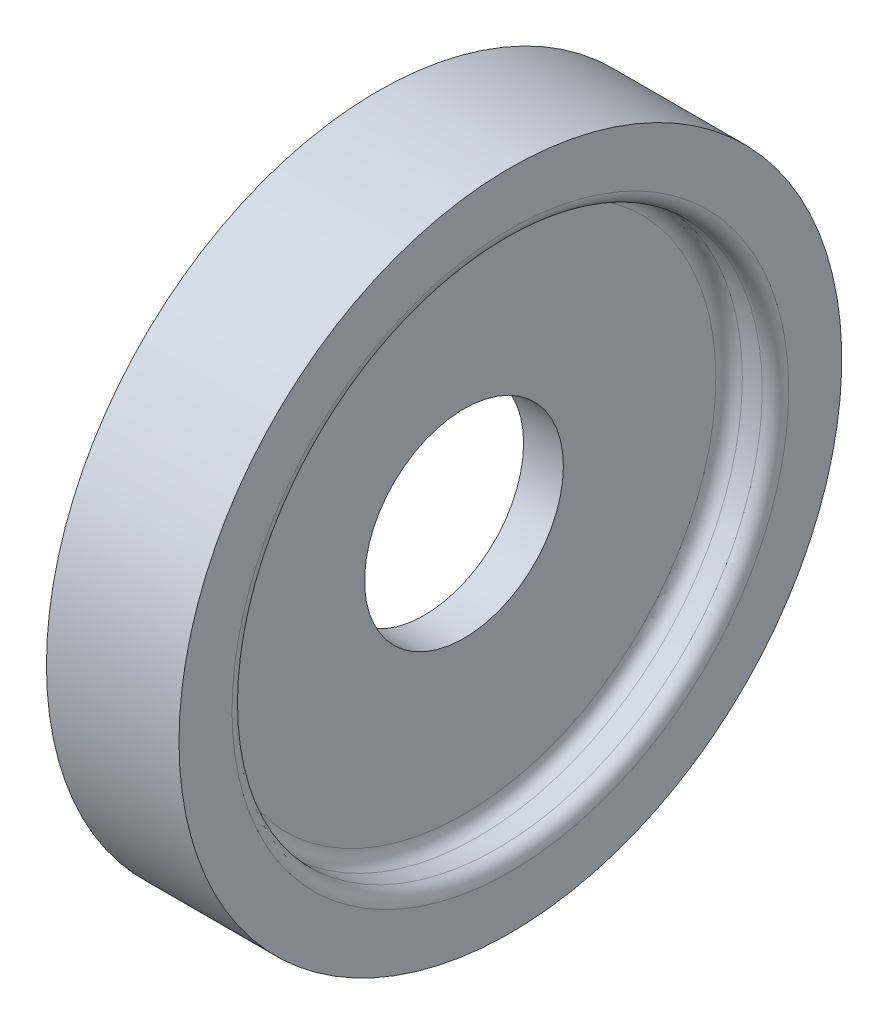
SolidWorks part; units mm, degrees
ref_plane "Front Plane" through (0, 0, 0) normal (0, 0, 1) x (1, 0, 0)
ref_plane "Top Plane" through (0, 0, 0) normal (0, 1, 0) x (1, 0, 0)
ref_plane "Right Plane" through (0, 0, 0) normal (1, 0, 0) x (0, 0, -1)
sketch "Sketch1" plane through (0, 0, 0) normal (0, 0, 1) x (1, 0, 0)
  line L0 (-24.414, 0) -> (24.9194, 0) construction
  line L1 (-1.5, 0) -> (1.5, 0)
  line L2 (1.5, 0) -> (1.5, 19)
  line L3 (2.5, 20) -> (4, 20)
  line L4 (5, 21) -> (5, 25)
  line L5 (5, 25) -> (-5, 25)
  line L6 (-5, 25) -> (-5, 21)
  line L7 (-4, 20) -> (-2.5, 20)
  line L8 (-1.5, 19) -> (-1.5, 0)
  arc A0 (4, 20) -> (5, 21) centre (4, 21) ccw
  arc A1 (-5, 21) -> (-4, 20) centre (-4, 21) ccw
  arc A2 (1.5, 19) -> (2.5, 20) centre (2.5, 19) cw
  arc A3 (-2.5, 20) -> (-1.5, 19) centre (-2.5, 19) cw
  point P8 (0, 0)
  point P12 (0, 0)
  point P13 (7.3638, 20)
  point P14 (0, 25)
  point P19 (-5, 20)
  point P22 (1.5, 20)
  point P25 (-1.5, 20)
  dimension "D5" = 1
  dimension "D1" = 5
  dimension "D2" = 3
  dimension "D3" = 20
  dimension "D4" = 10
revolve "Revolve1" add sketch "Sketch1" angle 360 about L0
sketch "Sketch2" plane through (1.5, 0, 0) normal (1, 0, 0) x (0, 0, -1)
  circle A0 centre (0, 0) radius 7.5
  dimension "D1" = 15
extrude "Cut-Extrude1" cut sketch "Sketch2" against normal up to next
